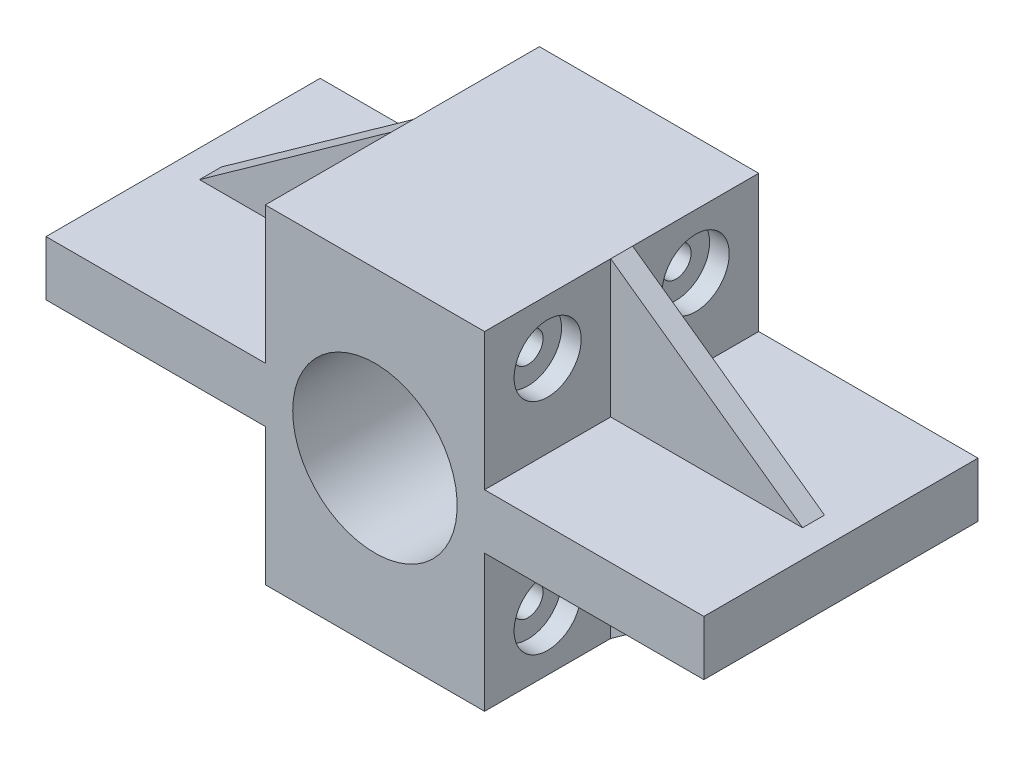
SolidWorks part; units mm, degrees
ref_plane "Front Plane" through (0, 0, 0) normal (0, 0, 1) x (1, 0, 0)
ref_plane "Top Plane" through (0, 0, 0) normal (0, 1, 0) x (1, 0, 0)
ref_plane "Right Plane" through (0, 0, 0) normal (1, 0, 0) x (0, 0, -1)
sketch "Sketch1" plane through (0, 0, 0) normal (0, 0, 1) x (1, 0, 0)
  line L0 (-60, 0) -> (-15, 0)
  line L1 (-60, 0) -> (-60, 5)
  line L2 (-60, 5) -> (-20, 5)
  line L3 (-20, 5) -> (-20, 30)
  line L4 (-20, 30) -> (20, 30)
  line L5 (0, 30) -> (0, 15) construction
  line L6 (20, 5) -> (20, 30)
  line L7 (60, 5) -> (20, 5)
  line L8 (60, 0) -> (60, 5)
  line L9 (60, 0) -> (15, 0)
  arc A0 (-15, 0) -> (15, 0) centre (0, 0) cw
  dimension "D5" = 15
  dimension "D1" = 5
  dimension "D2" = 20
  dimension "D3" = 30
  dimension "D4" = 60
extrude "Extrude1" add sketch "Sketch1" along normal mid plane 50
sketch "Sketch4" plane through (0, 0, 0) normal (0, 0, 1) x (1, 0, 0)
  line L0 (20, 30) -> (55, 5)
  line L2 (60, 5) -> (20, 5) construction
  line L3 (20, 5) -> (20, 30) construction
  dimension "D1" = 35
rib "Rib" sketch "Sketch4" sketch "Sketch4" thickness 4 extrusion direction parallel to sketch draft on no parameters "D1"=4
hole_wizard "CBORE for M5 Hex Head Bolt3" positions "Sketch9" profile "Sketch10" counterbore size "M5" standard "Ansi Metric"
sketch "Sketch9" plane through (20, 0, 0) normal (1, 0, 0) x (0, 0, -1)
  line L0 (-25, 20) -> (-2, 20) construction
  line L1 (-25, 5) -> (-25, 30) construction
  line L2 (-2, 5) -> (-2, 30) construction
  line L3 (-25, 30) -> (-2, 30) construction
  line L4 (0, 30) -> (0, 16.0984) construction
  line L5 (-2, 30) -> (2, 30) construction
  point P0 (-13.5, 20)
  point P25 (13.5, 20)
  dimension "D1" = 10
sketch "Sketch10" plane through (20, 20, 13.5) normal (0, 1, 0) x (0, 0, -1)
  line L0 (0, 0) -> (0, 11.6524)
  line L1 (0, 11.6524) -> (2.75, 10)
  line L2 (2.75, 10) -> (2.75, 3.58)
  line L3 (2.75, 3.58) -> (6.12, 3.58)
  line L4 (6.12, 3.58) -> (6.12, 0)
  line L5 (6.12, 0) -> (0, 0)
  line L10 (0, 11.6524) -> (-2.75, 10) construction
  line L11 (0, -6.35) -> (0, 107.95) construction
  dimension "Hole Dia." = 5.5
  dimension "Hole Depth" = 10
  dimension "C'Bore Dia." = 12.24
  dimension "C'Bore Depth" = 3.58
  dimension "Drill Angle" = 118
mirror "Mirror13" about plane through (0, 0, 0) normal (1, 0, 0) of "Rib", "CBORE for M5 Hex Head Bolt3"
mirror "Mirror15" about plane through (60, 0, 25) normal (0, 1, 0)
